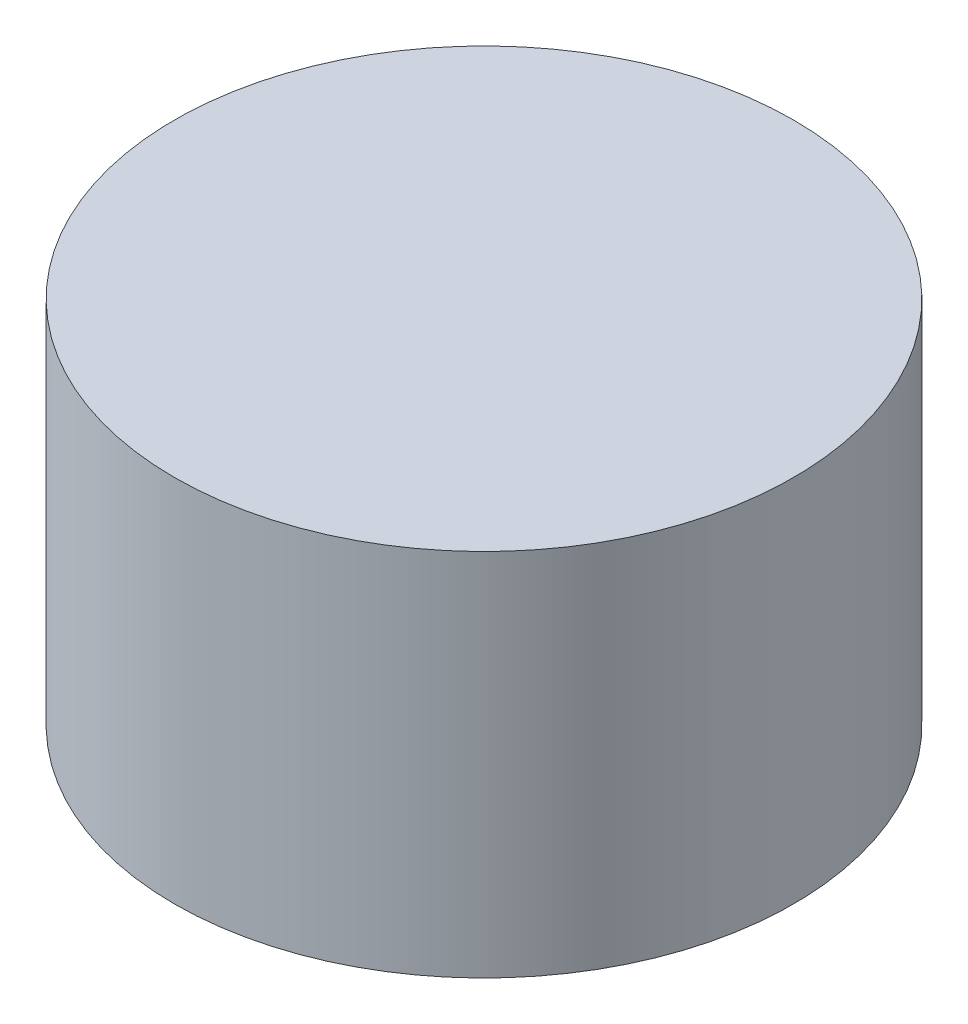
SolidWorks part; units mm, degrees
ref_plane "Ebene vorne" through (0, 0, 0) normal (0, 0, 1) x (1, 0, 0)
ref_plane "Ebene oben" through (0, 0, 0) normal (0, 1, 0) x (1, 0, 0)
ref_plane "Ebene rechts" through (0, 0, 0) normal (1, 0, 0) x (0, 0, -1)
sketch "Skizze1" plane through (0, 0, 0) normal (0, 1, 0) x (1, 0, 0)
  circle A0 centre (0, 0) radius 28.4975
extrude "Linear austragen1" add sketch "Skizze1" along normal blind 34
